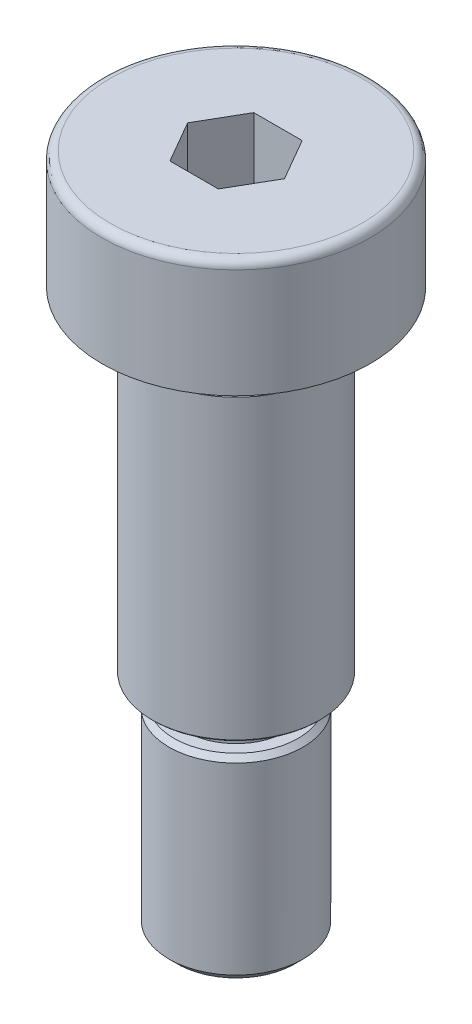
SolidWorks part; units mm, degrees
ref_plane "Plan1" through (0, 0, 0) normal (0, 0, 1) x (1, 0, 0)
ref_plane "Plan2" through (0, 0, 0) normal (0, 1, 0) x (1, 0, 0)
ref_plane "Plan3" through (0, 0, 0) normal (1, 0, 0) x (0, 0, -1)
sketch "Esquisse1" plane through (0, 0, 0) normal (0, 0, 1) x (1, 0, 0)
  line L0 (0, 50) -> (0, -40) construction
  line L1 (0, 40.25) -> (-7.5, 40.25)
  line L3 (-8, 39.75) -> (-8, 33.25)
  line L4 (-8, 33.25) -> (-4, 33.25)
  line L5 (-4, 33.25) -> (-4, 31.25)
  line L6 (-4, 31.25) -> (-5, 31.25)
  line L7 (-5, 31.25) -> (-5, 13.25)
  line L8 (-5, 13.25) -> (-3, 13.25)
  line L9 (-3, 13.25) -> (-3, 11.75)
  line L10 (-3, 11.75) -> (-4, 11.75)
  line L11 (-4, 11.75) -> (-4, 0)
  line L12 (-4, 0) -> (0, 0)
  line L13 (0, 40.25) -> (0, 0)
  arc A0 (-8, 39.75) -> (-7.5, 40.25) centre (-7.5, 39.75) cw
  dimension "D1" = 0.5
  dimension "D2" = 16
  dimension "D3" = 13.25
  dimension "D4" = 7
  dimension "D5" = 1
  dimension "D6" = 2
  dimension "D7" = 10
  dimension "D8" = 20
  dimension "D9" = 1
  dimension "D10" = 1.5
  dimension "D11" = 8
revolve "Base-Révolution" add sketch "Esquisse1" angle 360 about L0
sketch "Esquisse2" plane through (0, 40.25, 0) normal (0, 1, 0) x (-1, 0, 0)
  line L1 (2.8868, 0) -> (1.4434, 2.5)
  line L2 (1.4434, 2.5) -> (-1.4434, 2.5)
  line L3 (-1.4434, 2.5) -> (-2.8868, 0)
  line L4 (-2.8868, 0) -> (-1.4434, -2.5)
  line L5 (-1.4434, -2.5) -> (1.4434, -2.5)
  line L6 (1.4434, -2.5) -> (2.8868, 0)
  circle A0 centre (0, 0) radius 2.5 construction
  dimension "D1" = 5
extrude "Enlèv. mat.-Extru.1" cut sketch "Esquisse2" against normal blind 5
chamfer "Chanfrein1" distance 0.2 angle 45
fillet "Congé1" radius 0.1
chamfer "Chanfrein2" distance 0.1 angle 45
fillet "Congé2" radius 0.2
chamfer "Chanfrein3" distance 0.5 angle 45
chamfer "Chanfrein4" distance 0.3 angle 45
